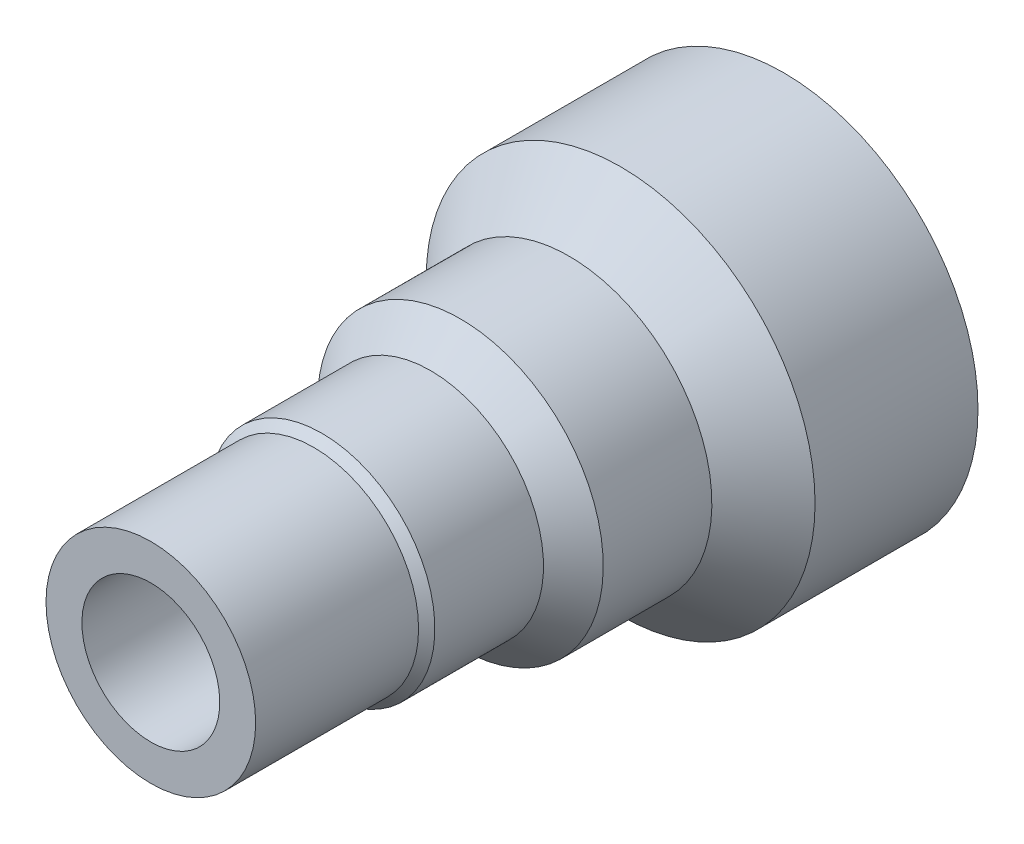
SolidWorks part; units mm, degrees
ref_plane "Front Plane" through (0, 0, 0) normal (0, 0, 1) x (1, 0, 0)
ref_plane "Top Plane" through (0, 0, 0) normal (0, 1, 0) x (1, 0, 0)
ref_plane "Right Plane" through (0, 0, 0) normal (1, 0, 0) x (0, 0, -1)
sketch "Sketch2" plane through (0, 0, 0) normal (1, 0, 0) x (0, 0, -1)
  line L0 (-39.2952, 0) -> (39.2952, 0) construction
  line L1 (22.2376, 3) -> (22.2376, 17.9)
  line L2 (22.2376, 17.9) -> (7.2376, 17.9)
  line L3 (2.4876, 13.15) -> (-7.5124, 13.15)
  line L4 (-10.2624, 10.4) -> (-20.2624, 10.4)
  line L5 (-21.0124, 9.65) -> (-36.0124, 9.65)
  line L6 (7.2376, 17.9) -> (2.4876, 13.15)
  line L7 (-7.5124, 13.15) -> (-10.2624, 10.4)
  line L8 (-20.2624, 10.4) -> (-21.0124, 9.65)
  line L9 (-36.0124, 9.65) -> (-36.0124, 6.3464)
  line L11 (39.2952, 0) -> (39.2952, 3) construction
  line L12 (39.2952, 3) -> (22.2376, 3) construction
  line L14 (22.2376, 3) -> (12.2376, 3)
  line L16 (-36.0124, 6.3464) -> (-26.0124, 6.3464)
  line L17 (-26.0124, 6.3464) -> (12.2376, 3)
  point P0 (-39.2952, 0)
  point P4 (0, 0)
  dimension "D1" = 14.9
  dimension "D2" = 13.15
  dimension "D3" = 10.4
  dimension "D4" = 9.65
  dimension "D5" = 15
  dimension "D6" = 10
  dimension "D7" = 10
  dimension "D8" = 15
  dimension "D9" = 45
  dimension "D10" = 45
  dimension "D11" = 45
  dimension "D12" = 3
  dimension "D13" = 5
  dimension "D14" = 10
  dimension "D15" = 10
revolve "Revolve1" add sketch "Sketch2" angle 360 about L0
